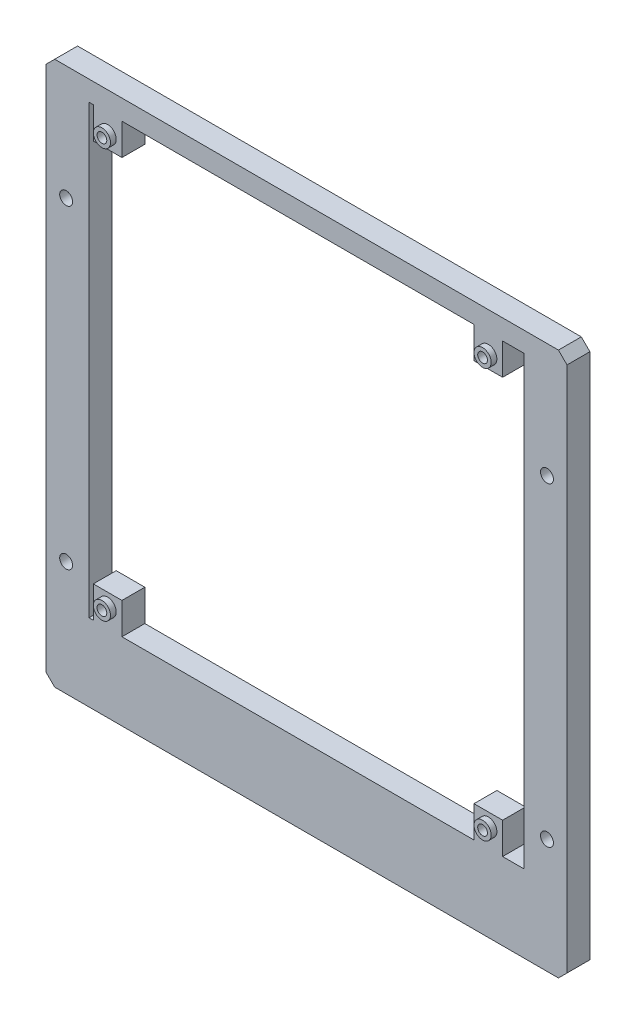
SolidWorks part; units mm, degrees
ref_plane "前视基准面" through (0, 0, 0) normal (0, 0, 1) x (1, 0, 0)
ref_plane "上视基准面" through (0, 0, 0) normal (0, 1, 0) x (1, 0, 0)
ref_plane "右视基准面" through (0, 0, 0) normal (1, 0, 0) x (0, 0, -1)
other "Configuration Table"
sketch "草图1" plane through (0, 0, 0) normal (0, 0, 1) x (1, 0, 0)
  line L0 (-98, -95) -> (78, -95)
  line L1 (78, -95) -> (81, -92)
  line L2 (81, -92) -> (81, 92)
  line L3 (81, 92) -> (78, 95)
  line L4 (78, 95) -> (-98, 95)
  line L5 (-98, 95) -> (-101, 92)
  line L6 (-101, 92) -> (-101, -92)
  line L7 (-101, -92) -> (-98, -95)
  line L8 (-86, -68) -> (66, -68)
  line L9 (66, -68) -> (66, 88)
  line L10 (66, 88) -> (-86, 88)
  line L11 (-86, 88) -> (-86, -68)
  circle A0 centre (-94, -55) radius 2.25
  circle A1 centre (-94, 55) radius 2.25
  circle A2 centre (74, -55) radius 2.25
  circle A3 centre (74, 55) radius 2.25
  dimension "D1" = 4.5
  dimension "D2" = 66
  dimension "D3" = 74
  dimension "D4" = 78
  dimension "D5" = 81
  dimension "D6" = 86
  dimension "D7" = 94
  dimension "D8" = 98
  dimension "D9" = 55
  dimension "D10" = 88
  dimension "D11" = 92
  dimension "D12" = 95
  dimension "D13" = 55
  dimension "D14" = 68
  dimension "D15" = 92
extrude "Common_open_frame_M4_holes" add sketch "草图1" along normal blind 8
sketch "草图2" plane through (0, 0, 0) normal (0, 0, 1) x (1, 0, 0)
  line L0 (-84.5, -92) -> (-74.5, -92)
  line L1 (-74.5, -92) -> (-74.5, -57)
  line L2 (-74.5, -57) -> (-84.5, -57)
  line L3 (-84.5, -57) -> (-84.5, -92)
  circle A0 centre (-79.5, -61.5) radius 1.7
  dimension "D1" = 3.4
  dimension "D2" = 74.5
  dimension "D3" = 79.5
  dimension "D4" = 84.5
  dimension "D5" = 57
  dimension "D6" = 61.5
  dimension "D7" = 92
extrude "Joined_PCB_mount_tab_1" add sketch "草图2" along normal blind 8
sketch "草图3" plane through (0, 0, 0) normal (0, 0, 1) x (1, 0, 0)
  line L0 (48.5, -92) -> (58.5, -92)
  line L1 (58.5, -92) -> (58.5, -57)
  line L2 (58.5, -57) -> (48.5, -57)
  line L3 (48.5, -57) -> (48.5, -92)
  circle A0 centre (53.5, -61.5) radius 1.7
  dimension "D1" = 3.4
  dimension "D2" = 48.5
  dimension "D3" = 53.5
  dimension "D4" = 58.5
  dimension "D5" = 57
  dimension "D6" = 61.5
  dimension "D7" = 92
extrude "Joined_PCB_mount_tab_2" add sketch "草图3" along normal blind 8
sketch "草图4" plane through (0, 0, 0) normal (0, 0, 1) x (1, 0, 0)
  line L0 (-84.5, 77) -> (-74.5, 77)
  line L1 (-74.5, 77) -> (-74.5, 92)
  line L2 (-74.5, 92) -> (-84.5, 92)
  line L3 (-84.5, 92) -> (-84.5, 77)
  circle A0 centre (-79.5, 81.5) radius 1.7
  dimension "D1" = 3.4
  dimension "D2" = 74.5
  dimension "D3" = 79.5
  dimension "D4" = 84.5
  dimension "D5" = 77
  dimension "D6" = 81.5
  dimension "D7" = 92
extrude "Joined_PCB_mount_tab_3" add sketch "草图4" along normal blind 8
sketch "草图5" plane through (0, 0, 0) normal (0, 0, 1) x (1, 0, 0)
  line L0 (48.5, 77) -> (58.5, 77)
  line L1 (58.5, 77) -> (58.5, 92)
  line L2 (58.5, 92) -> (48.5, 92)
  line L3 (48.5, 92) -> (48.5, 77)
  circle A0 centre (53.5, 81.5) radius 1.7
  dimension "D1" = 3.4
  dimension "D2" = 48.5
  dimension "D3" = 53.5
  dimension "D4" = 58.5
  dimension "D5" = 77
  dimension "D6" = 81.5
  dimension "D7" = 92
extrude "Joined_PCB_mount_tab_4" add sketch "草图5" along normal blind 8
sketch "草图6" plane through (0, 0, 0) normal (0, 0, 1) x (1, 0, 0)
  circle A0 centre (-79.5, -61.5) radius 3
  circle A1 centre (-79.5, -61.5) radius 1.7
  circle A2 centre (53.5, -61.5) radius 3
  circle A3 centre (53.5, -61.5) radius 1.7
  circle A4 centre (-79.5, 81.5) radius 3
  circle A5 centre (-79.5, 81.5) radius 1.7
  circle A6 centre (53.5, 81.5) radius 3
  circle A7 centre (53.5, 81.5) radius 1.7
  dimension "D1" = 3.4
  dimension "D2" = 6
  dimension "D3" = 53.5
  dimension "D4" = 79.5
  dimension "D5" = 81.5
  dimension "D6" = 61.5
extrude "Four_front_contact_bosses_OD6" add sketch "草图6" along normal blind 2 from offset 8
